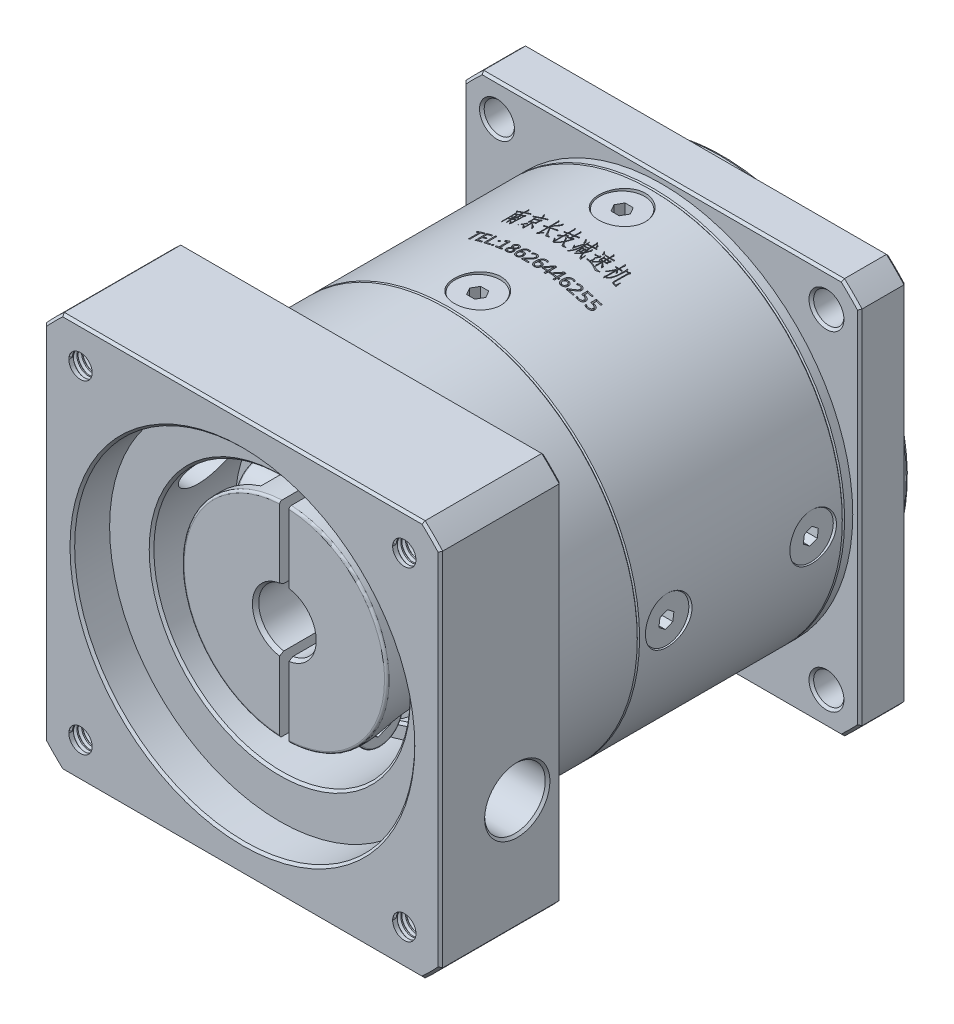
SolidWorks part; units mm, degrees
ref_plane "前视基准面" through (0, 0, 0) normal (0, 0, 1) x (1, 0, 0)
ref_plane "上视基准面" through (0, 0, 0) normal (0, 1, 0) x (1, 0, 0)
ref_plane "右视基准面" through (0, 0, 0) normal (1, 0, 0) x (0, 0, -1)
imported_body "12.7-73-69.5X69.5-M6-1-solid1"
imported_body "12.7-73-69.5X69.5-M6-1-solid2"
imported_body "12.7-73-69.5X69.5-M6-1-solid3"
imported_body "12.7-73-69.5X69.5-M6-1-solid4"
imported_body "ZF80-K15-L1-1-solid1"
imported_body "ZF80-K15-L1-1-solid2"
imported_body "ZF80-K15-L1-1-solid3"
imported_body "ZF80-K15-L1-1-solid4"
imported_body "ZF80-K15-L1-1-solid5"
imported_body "ZF80-K15-L1-1-solid6"
imported_body "ZF80-K15-L1-1-solid7"
imported_body "ZF80-K15-L1-1-solid8"
imported_body "ZF80-K15-L1-1-solid9"
sketch "草图1" plane through (0, 0, 38.75) normal (0, 0, -1) x (-1, 0, 0)
  circle A0 centre (-24.696, 4.3698) radius 11.0563
  dimension "D1" = 22.1127
extrude "凸台-拉伸1" add sketch "草图1" along normal blind 5
